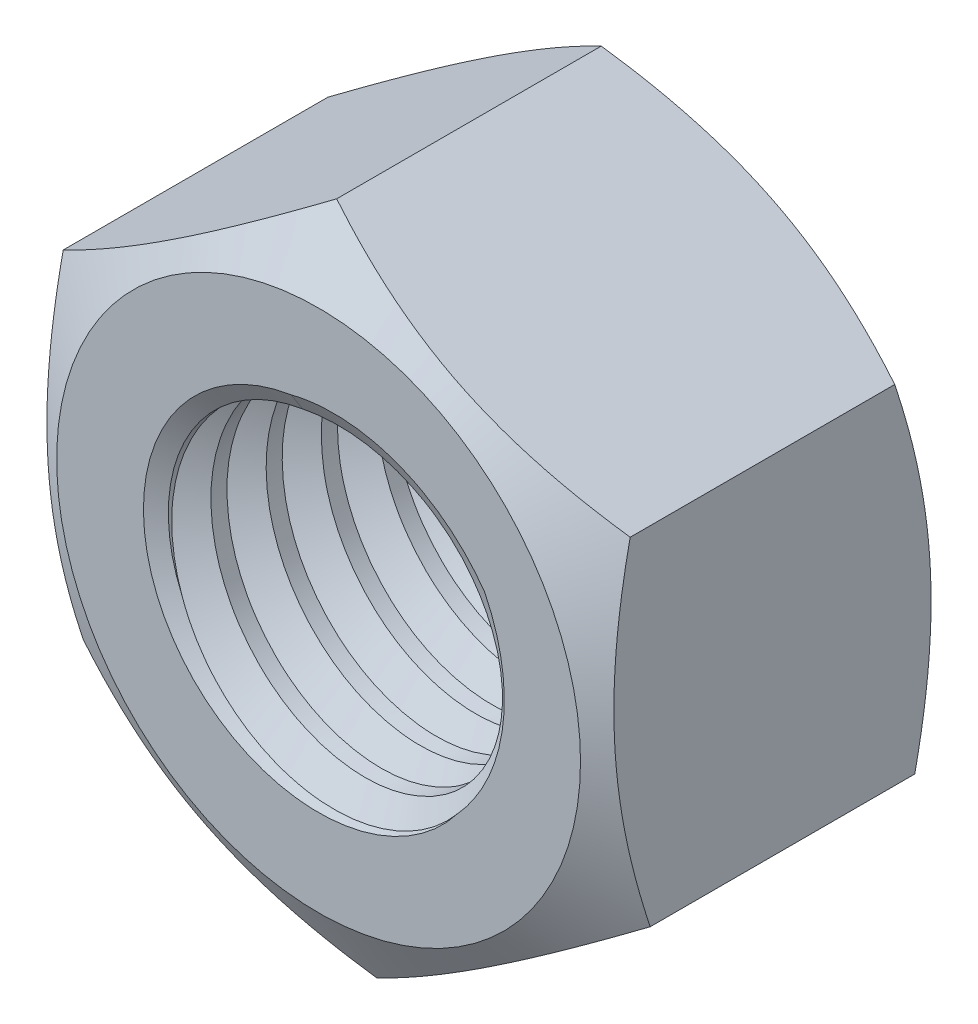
SolidWorks part; units mm, degrees
ref_plane "Front Plane" through (0, 0, 0) normal (0, 0, 1) x (1, 0, 0)
ref_plane "Top Plane" through (0, 0, 0) normal (0, 1, 0) x (1, 0, 0)
ref_plane "Right Plane" through (0, 0, 0) normal (1, 0, 0) x (0, 0, -1)
sketch "Sketch1" plane through (0, 0, 0) normal (0, 0, 1) x (1, 0, 0)
  line L1 (8.6657, 5.7364) -> (-0.6351, 10.3729)
  line L2 (-0.6351, 10.3729) -> (-9.3007, 4.6365)
  line L3 (-9.3007, 4.6365) -> (-8.6657, -5.7364)
  line L4 (-8.6657, -5.7364) -> (0.6351, -10.3729)
  line L5 (0.6351, -10.3729) -> (9.3007, -4.6365)
  line L6 (9.3007, -4.6365) -> (8.6657, 5.7364)
  circle A0 centre (0, 0) radius 9 construction
  circle A1 centre (0, 0) radius 5.05
extrude "Boss-Extrude1" add sketch "Sketch1" along normal mid plane 10.8
sketch "Sketch2" plane through (0, 0, 5.4) normal (0, 0, 1) x (1, 0, 0)
  circle A0 centre (0, 0) radius 8.3
extrude "Cut-Extrude1" cut sketch "Sketch2" against normal through all draft 60 flip side to cut
mirror "Mirror1" about plane through (0, 0, 0) normal (0, 0, 1) of "Cut-Extrude1"
chamfer "Chamfer1" distance 0.5 angle 30 2 edges at (5.05, 0, -5.4) (5.05, 0, 5.4)
sketch "Sketch3" plane through (0, 0, 5.4) normal (0, 0, 1) x (1, 0, 0)
  circle A0 centre (0, 0) radius 5.05
sketch "Sketch6" plane through (0, 0, 5.4) normal (0, 0, 1) x (1, 0, 0)
  circle A0 centre (0, 0) radius 5.05
curve "Helix/Spiral2"
sketch "Sketch7" plane through (0, 0, 0) normal (0, 1, 0) x (1, 0, 0)
  line L1 (6.125, -7) -> (4.5125, -6.069)
  line L2 (4.5125, -6.069) -> (4.5125, -7.931)
  line L3 (4.5125, -7.931) -> (6.125, -7)
  circle A0 centre (5.05, -7) radius 1.075 construction
sweep "Cut-Sweep1" cut profiles "Sketch7" path "Helix/Spiral2"
